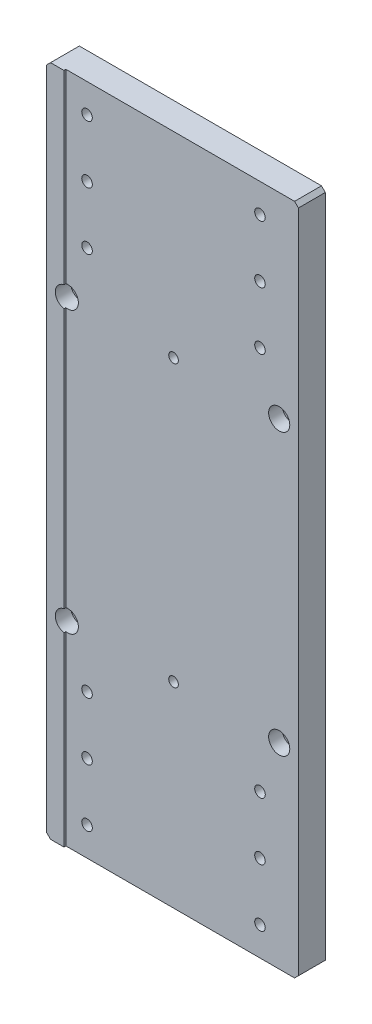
SolidWorks part; units mm, degrees
ref_plane "정면" through (0, 0, 0) normal (0, 0, 1) x (1, 0, 0)
ref_plane "윗면" through (0, 0, 0) normal (0, 1, 0) x (1, 0, 0)
ref_plane "우측면" through (0, 0, 0) normal (1, 0, 0) x (0, 0, -1)
sketch "스케치1" plane through (0, 0, 0) normal (0, 0, 1) x (1, 0, 0)
  line L1 (-65, 175) -> (65, 175)
  line L2 (-65, 175) -> (-65, -175)
  line L3 (-65, -175) -> (65, -175)
  line L4 (65, 175) -> (65, -175)
  line L5 (-65, 175) -> (65, -175) construction
  line L6 (-65, -175) -> (65, 175) construction
  point P0 (0, 0)
  dimension "D1" = 130
  dimension "D2" = 350
extrude "보스-돌출1" add sketch "스케치1" along normal mid plane 15
sketch "스케치2" plane through (0, 0, 7.5) normal (0, 0, 1) x (1, 0, 0)
  line L0 (65, 175) -> (-65, 175) construction
  line L1 (-56, 175) -> (65, 175)
  line L2 (-56, 175) -> (-56, -175)
  line L3 (-56, -175) -> (65, -175)
  line L4 (65, 175) -> (65, -175)
  line L5 (-65, 175) -> (-65, -175) construction
  dimension "D1" = 9
extrude "컷-돌출1" cut sketch "스케치2" against normal blind 1
hole_wizard "M6 소켓 머리 캡 나사용 카운터보어1" positions "스케치5" profile "스케치6" counterbore size "M6" standard "KS"
sketch "스케치5" plane through (0, 0, 7.5) normal (0, 0, 1) x (1, 0, 0)
  line L0 (65, 175) -> (-56, 175) construction
  line L1 (-65, 175) -> (-65, -175) construction
  point P0 (-55, 73)
  point P2 (55, 73)
  point P4 (-55, -73)
  point P6 (55, -73)
  dimension "D1" = 102
  dimension "D2" = 146
  dimension "D3" = 10
  dimension "D4" = 110
sketch "스케치6" plane through (-55, 73, 7.5) normal (1, 0, 0) x (0, -1, 0)
  line L0 (0, 0) -> (0, 15)
  line L1 (0, 15) -> (3.3, 15)
  line L3 (3.3, 15) -> (3.3, 8)
  line L4 (3.3, 8) -> (5.5, 8)
  line L5 (5.5, 8) -> (5.5, 0)
  line L7 (5.5, 0) -> (0, 0)
  line L11 (0, -6.35) -> (0, 107.95) construction
  dimension "관통 구멍 지름" = 6.6
  dimension "관통 구멍 깊이" = 15
  dimension "카운터보어 지름" = 11
  dimension "카운터보어 깊이" = 8
hole_wizard "M5 소켓 머리 캡 나사용 카운터보어1" positions "스케치7" profile "스케치8" counterbore size "M5" standard "KS"
sketch "스케치7" plane through (0, 0, -7.5) normal (0, 0, -1) x (-1, 0, 0)
  line L0 (-65, -175) -> (-65, 175) construction
  line L2 (-65, 175) -> (65, 175) construction
  point P0 (-45, 160)
  point P2 (45, 160)
  point P4 (-45, 130)
  point P6 (45, 130)
  point P8 (45, 100)
  point P10 (-45, 100)
  dimension "D1" = 20
  dimension "D2" = 90
  dimension "D3" = 15
  dimension "D4" = 30
  dimension "D5" = 30
sketch "스케치8" plane through (45, 160, -7.5) normal (1, 0, 0) x (0, 1, 0)
  line L0 (0, 0) -> (0, 15)
  line L1 (0, 15) -> (2.75, 15)
  line L3 (2.75, 15) -> (2.75, 7)
  line L4 (2.75, 7) -> (4.75, 7)
  line L5 (4.75, 7) -> (4.75, 0)
  line L7 (4.75, 0) -> (0, 0)
  line L11 (0, -6.35) -> (0, 107.95) construction
  dimension "관통 구멍 지름" = 5.5
  dimension "관통 구멍 깊이" = 15
  dimension "카운터보어 지름" = 9.5
  dimension "카운터보어 깊이" = 7
pattern_linear "선형 패턴1" count 2 spacing 260 along (0, -1, 0) of "M5 소켓 머리 캡 나사용 카운터보어1"
hole_wizard "Ø5.0mm 맞춤핀 구멍1" positions "스케치9" profile "스케치10" hole size "Ø5.0" standard "ISO"
sketch "스케치9" plane through (0, 0, 6.5) normal (0, 0, 1) x (1, 0, 0)
  line L0 (0, 0) -> (0, 193.2449) construction
  line L1 (65, 175) -> (-56, 175) construction
  point P6 (0, 73)
  point P8 (0, -73)
  dimension "D1" = 146
  dimension "D2" = 102
sketch "스케치10" plane through (0, -73, 6.5) normal (1, 0, 0) x (0, -1, 0)
  line L0 (0, 0) -> (0, 14)
  line L1 (0, 14) -> (2.5, 14)
  line L2 (2.5, 14) -> (2.5, 0)
  line L5 (2.5, 0) -> (0, 0)
  line L11 (0, -6.35) -> (0, 107.95) construction
  dimension "관통 구멍 지름" = 5
  dimension "관통 구멍 깊이" = 14
chamfer "모따기1" distance 2 angle 45 4 edges at (-65, -175, 0) (65, -175, -0.5) (-65, 175, 0) (65, 175, -0.5)
